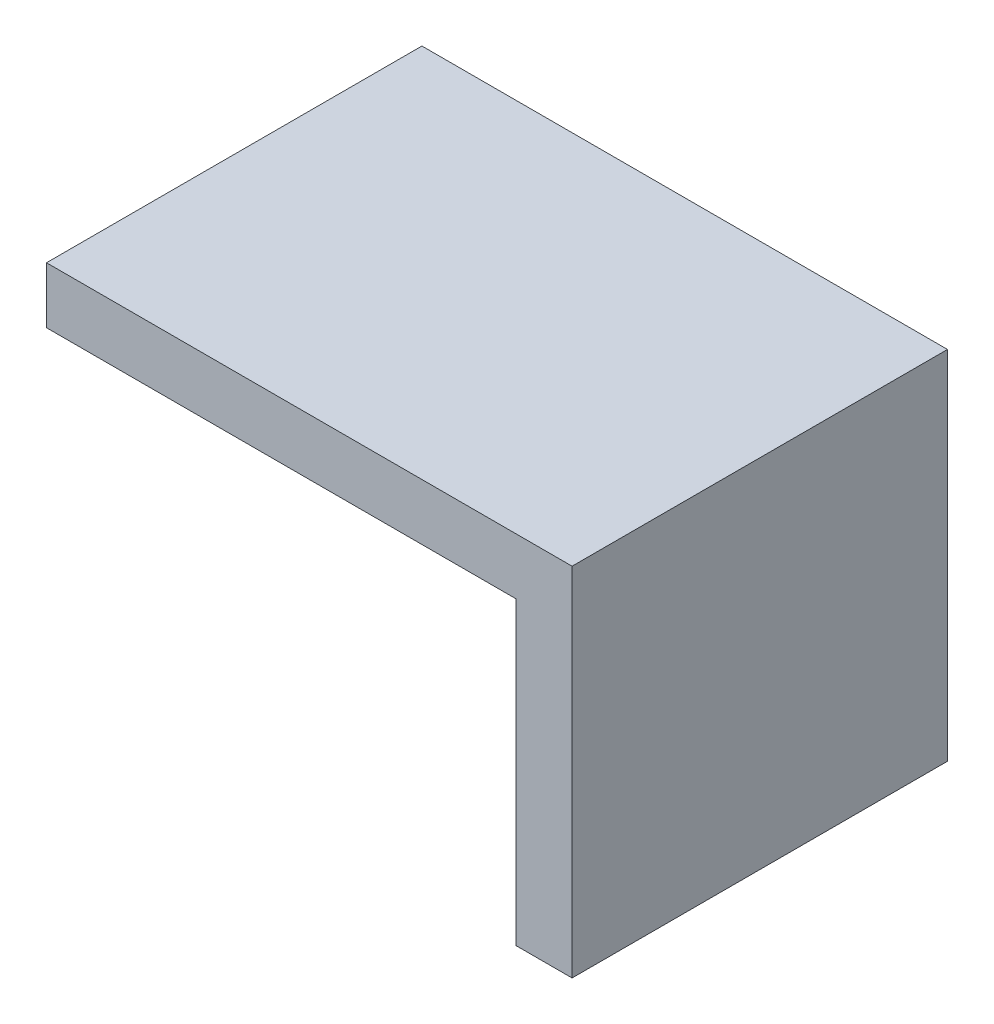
SolidWorks part; units mm, degrees
ref_plane "Front Plane" through (0, 0, 0) normal (0, 0, 1) x (1, 0, 0)
ref_plane "Top Plane" through (0, 0, 0) normal (0, 1, 0) x (1, 0, 0)
ref_plane "Right Plane" through (0, 0, 0) normal (1, 0, 0) x (0, 0, -1)
sketch "Sketch1" plane through (0, 0, 0) normal (0, 0, 1) x (1, 0, 0)
  line L3 (22.6115, 16) -> (47.6115, 16)
  line L4 (47.6115, 16) -> (47.6115, 0)
  line L5 (47.6115, 0) -> (50.6115, 0)
  line L9 (50.6115, 19) -> (22.6115, 19)
  line L13 (50.6115, 0) -> (50.6115, 19)
  line L14 (22.6115, 16) -> (22.6115, 19)
  point P4 (0, 0)
  dimension "D1" = 28
  dimension "D6" = 3
  dimension "D8" = 3
extrude "Boss-Extrude1" add sketch "Sketch1" against normal blind 20
